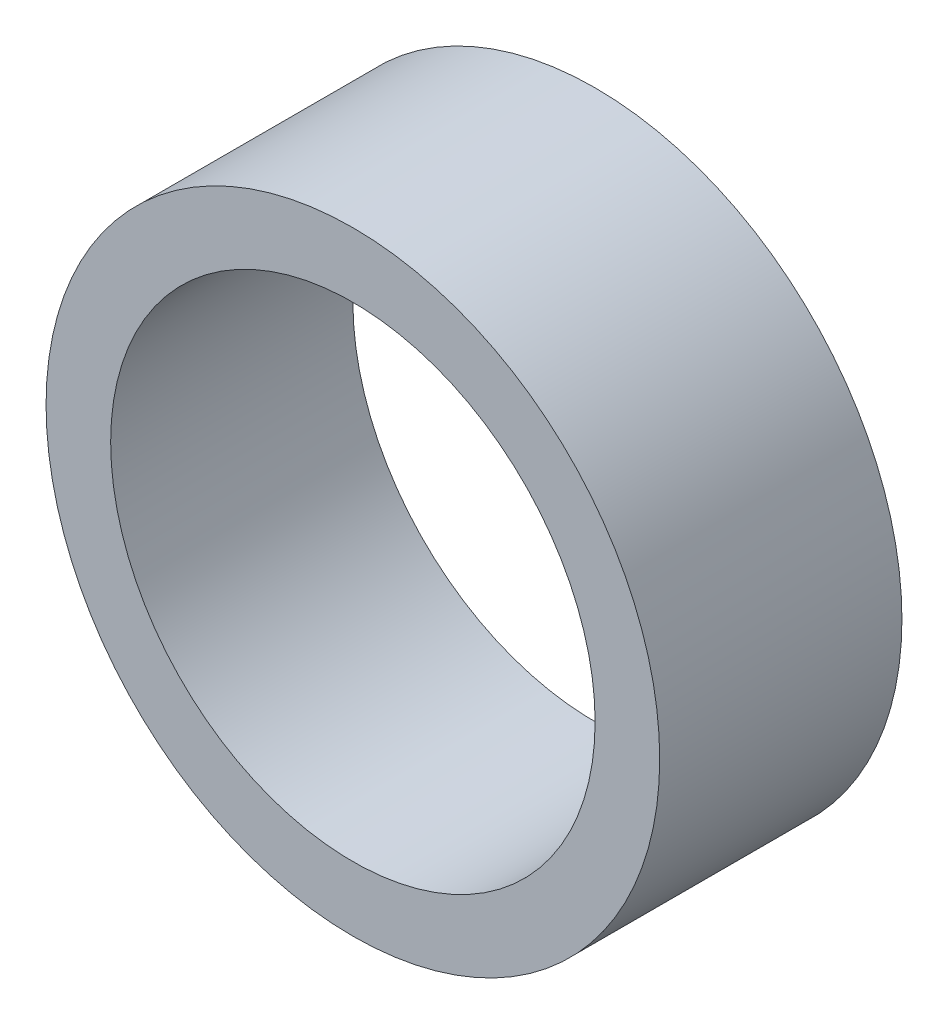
SolidWorks part; units mm, degrees
ref_plane "Plan1" through (0, 0, 0) normal (0, 0, 1) x (1, 0, 0)
ref_plane "Plan2" through (0, 0, 0) normal (0, 1, 0) x (1, 0, 0)
ref_plane "Plan3" through (0, 0, 0) normal (1, 0, 0) x (0, 0, -1)
sketch "Esquisse1" plane through (0, 0, 0) normal (0, 0, 1) x (1, 0, 0)
  circle A0 centre (0, 0) radius 19
  circle A1 centre (0, 0) radius 15
  dimension "D1" = 38
  dimension "D2" = 30
extrude "Base-Extrusion" add sketch "Esquisse1" along normal mid plane 15
